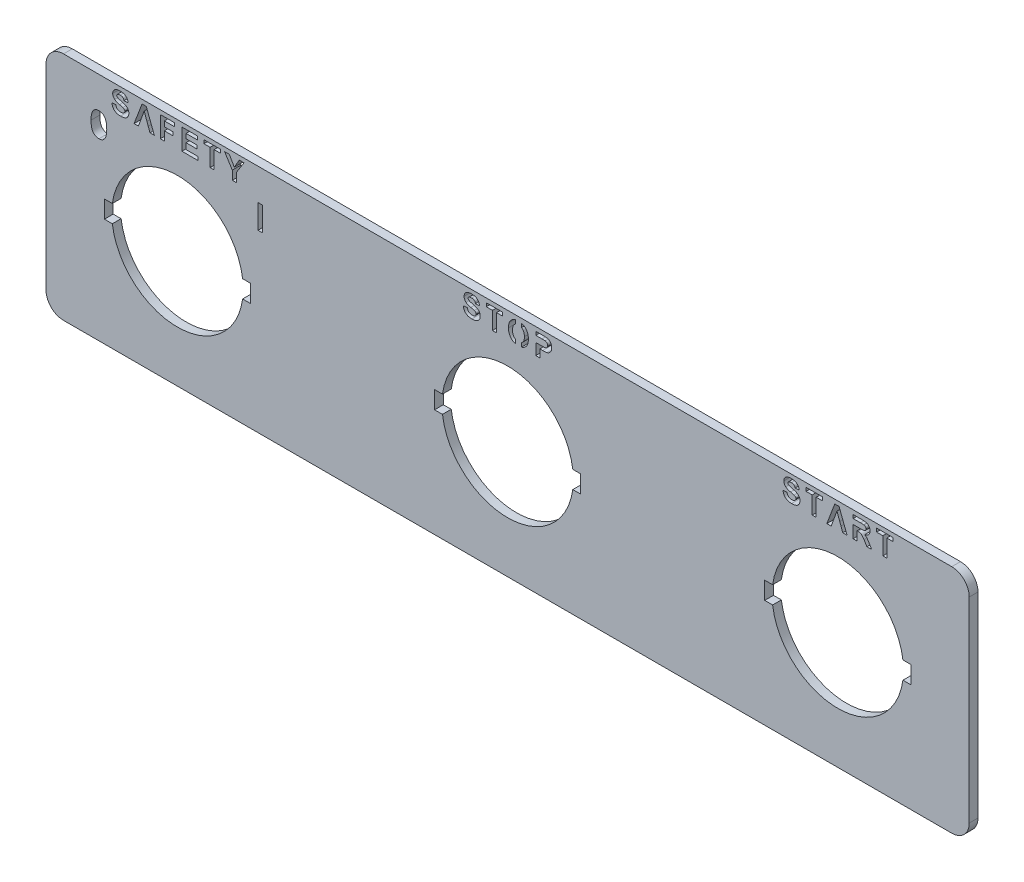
SolidWorks part; units mm, degrees
ref_plane "Ebene vorne" through (0, 0, 0) normal (0, 0, 1) x (1, 0, 0)
ref_plane "Ebene oben" through (0, 0, 0) normal (0, 1, 0) x (1, 0, 0)
ref_plane "Ebene rechts" through (0, 0, 0) normal (1, 0, 0) x (0, 0, -1)
sketch "Skizze3" plane through (0, 0, 0) normal (0, 0, 1) x (1, 0, 0)
  line L5 (11.1496, 1.5) -> (12.5, 1.5)
  line L6 (-12.5, -1.5) -> (-11.1496, -1.5)
  line L14 (-12.5, -1.5) -> (-12.5, 1.5)
  line L18 (-12.5, 1.5) -> (-11.1496, 1.5)
  line L19 (12.5, -1.5) -> (12.5, 1.5)
  line L21 (-12.5, -1.5) -> (12.5, 1.5) construction
  line L22 (-12.5, 1.5) -> (12.5, -1.5) construction
  line L23 (11.1496, -1.5) -> (12.5, -1.5)
  line L24 (67.6496, 1.5) -> (69, 1.5)
  line L25 (44, -1.5) -> (45.3504, -1.5)
  line L26 (44, -1.5) -> (44, 1.5)
  line L27 (44, 1.5) -> (45.3504, 1.5)
  line L28 (69, -1.5) -> (69, 1.5)
  line L29 (44, -1.5) -> (69, 1.5) construction
  line L30 (44, 1.5) -> (69, -1.5) construction
  line L31 (67.6496, -1.5) -> (69, -1.5)
  line L32 (124.1496, 1.5) -> (125.5, 1.5)
  line L33 (100.5, -1.5) -> (101.8504, -1.5)
  line L34 (100.5, -1.5) -> (100.5, 1.5)
  line L35 (100.5, 1.5) -> (101.8504, 1.5)
  line L36 (125.5, -1.5) -> (125.5, 1.5)
  line L37 (100.5, -1.5) -> (125.5, 1.5) construction
  line L38 (100.5, 1.5) -> (125.5, -1.5) construction
  line L39 (124.1496, -1.5) -> (125.5, -1.5)
  line L40 (44, 15.2) -> (69, 15.2) construction
  line L45 (-15, 10) -> (15, 10) construction
  line L46 (132.5, 19.5) -> (-19.5, 19.5)
  line L47 (100.5, 15.2) -> (125.5, 15.2) construction
  line L48 (135.5, 16.5) -> (135.5, -17)
  line L49 (-12.5, 15.2) -> (12.5, 15.2) construction
  line L50 (132.5, -20) -> (-19.5, -20)
  line L51 (-22.5, 16.5) -> (-22.5, -17)
  arc A9 (-11.1496, -1.5) -> (11.1496, -1.5) centre (0, 0) ccw
  arc A10 (11.1496, 1.5) -> (-11.1496, 1.5) centre (0, 0) ccw
  arc A11 (45.3504, -1.5) -> (67.6496, -1.5) centre (56.5, 0) ccw
  arc A12 (67.6496, 1.5) -> (45.3504, 1.5) centre (56.5, 0) ccw
  arc A13 (101.8504, -1.5) -> (124.1496, -1.5) centre (113, 0) ccw
  arc A14 (124.1496, 1.5) -> (101.8504, 1.5) centre (113, 0) ccw
  circle A15 centre (0, 0) radius 14.25 construction
  circle A16 centre (56.5, 0) radius 14.25 construction
  circle A17 centre (113, 0) radius 14.25 construction
  arc A18 (132.5, 19.5) -> (135.5, 16.5) centre (132.5, 16.5) cw
  arc A19 (135.5, -17) -> (132.5, -20) centre (132.5, -17) cw
  arc A20 (-19.5, -20) -> (-22.5, -17) centre (-19.5, -17) cw
  arc A21 (-19.5, 19.5) -> (-22.5, 16.5) centre (-19.5, 16.5) ccw
  point P38 (0, 10)
  dimension "D3" = 25
  dimension "D4" = 56.5
  dimension "D6" = 56.5
  dimension "D7" = 10
  dimension "D11" = 28.5
  dimension "D1" = 22.5
  dimension "D14" = 3
  dimension "D2" = 3
  dimension "D5" = 10
  dimension "D8" = 20
  dimension "D9" = 19.5
  dimension "D10" = 4.3
  dimension "D12" = 30
  dimension "D13" = 10
sketch "Skizze4" plane through (0, 0, 0) normal (0, 0, 1) x (1, 0, 0)
  text T0 "SAFETY" font "Arial" height in points 14
  text T1 "STOP" font "Arial" height in points 14
  text T2 "START" font "Arial" height in points 14
  text T3 "0" font "Arial" height in points 16
  text T4 "I" font "Arial" height in points 16
extrude "Aufsatz-Linear austragen1" add sketch "Skizze3" along normal blind 1.5
extrude "Schnitt-Linear austragen1" cut sketch "Skizze4" along normal through all
sketch "Skizze6" plane through (0, 0, 1.5) normal (0, 0, 1) x (1, 0, 0)
  spline S6 degree 3 poles (3873.6577, -933.3469) (-39.5137, 8.3469) (-13.7865, 6.7817) (-12.9406, 11.2113) (-12.9261, 11.3163) (-12.914, 11.4338) (-12.904, 11.5642) (-12.8979, 11.7072) (-12.609, 22.3337) (-34.1388, 33.2601) (3986.7867, -20.2946) knots -13.264132 -13.264132 -13.264132 -13.264132 0.082643 0.176812 0.282638 0.401264 0.531994 0.675701 0.831686 32.493345 32.493345 32.493345 32.493345 only from (-12.9807, 11.0356) to (-12.8927, 12.0267)
  spline S7 degree 3 poles (3986.6819, 50.9542) (-37.5673, -6.4828) (-12.6072, 3.116) (-12.8974, 12.3442) (-12.9022, 12.4848) (-12.9119, 12.6115) (-12.9216, 12.7248) (-12.9361, 12.824) (-12.9506, 12.9104) (-12.9756, 13.0036) (-13.0095, 13.1016) (-13.0557, 13.2013) (-13.1081, 13.2798) (-13.1675, 13.3374) (-13.232, 13.3763) (-13.2994, 13.4043) (-16.3228, 14.1045) (-23.0838, -19.3787) (415.0507, 3990.1408) knots -16.330429 -16.330429 -16.330429 -16.330429 0.100697 0.193034 0.277511 0.35372 0.421648 0.48196 0.534145 0.579041 0.655378 0.720508 0.776233 0.824061 0.868169 0.910885 0.954949 6.415181 6.415181 6.415181 6.415181 only from (-12.8927, 12.0267) to (-13.4458, 13.4244)
  spline S8 degree 3 poles (-457.9549, 3988.5028) (-3.6833, -19.5071) (-10.5836, 14.1072) (-13.5925, 13.4042) (-13.6605, 13.3764) (-13.7249, 13.3376) (-13.7842, 13.2837) (-13.8344, 13.2113) (-15.7306, 9.3294) (16.2937, -7.5721) (-3751.4808, 1437.4768) knots -13.457133 -13.457133 -13.457133 -13.457133 0.112424 0.222385 0.330122 0.441243 0.558075 0.686949 0.834033 19.885814 19.885814 19.885814 19.885814 only from (-13.4458, 13.4244) to (-13.9109, 13.0211)
  spline S9 degree 3 poles (-3901.6055, 952.9122) (12.8697, 15.5823) (-13.1246, 17.2303) (-13.9511, 12.8445) (-13.9655, 12.7389) (-13.9777, 12.6209) (-13.9877, 12.4902) (-13.9938, 12.3469) (-14.2827, 1.6908) (7.2925, -9.2596) (-4013.6656, 43.0855) knots -13.079113 -13.079113 -13.079113 -13.079113 0.082373 0.177042 0.283337 0.401576 0.532699 0.675937 0.831413 32.478628 32.478628 32.478628 32.478628 only from (-13.9109, 13.0211) to (-13.999, 12.0267)
  spline S10 degree 3 poles (-4012.9474, 89.5388) (1.4049, 40.4513) (-14.2348, 26.1724) (-13.9951, 11.7094) (-13.9878, 11.5692) (-13.9806, 11.4423) (-13.9685, 11.329) (-13.9564, 11.2291) (-13.9396, 11.1432) (-13.9168, 11.0498) (-13.8822, 10.952) (-13.8348, 10.8534) (-13.784, 10.7742) (-13.7241, 10.7175) (-13.6593, 10.6794) (-13.5921, 10.6515) (-10.4784, 9.973) (-4.0347, 42.5474) (-405.5827, -3969.4199) knots -25.774494 -25.774494 -25.774494 -25.774494 0.100835 0.193283 0.277401 0.353678 0.422236 0.482563 0.534908 0.579742 0.655714 0.721145 0.776666 0.824218 0.868127 0.911357 0.954889 6.572718 6.572718 6.572718 6.572718 only from (-13.999, 12.0267) to (-13.4458, 10.6322)
  spline S11 degree 3 poles (464.8514, -3960.4286) (-23.5123, 44.3755) (-16.2613, 9.9385) (-13.2988, 10.6528) (-13.2306, 10.6798) (-13.1667, 10.7193) (-13.1075, 10.7729) (-13.0573, 10.8453) (-11.1616, 14.7243) (-43.188, 31.6756) (3722.6956, -1418.4246) knots -13.272477 -13.272477 -13.272477 -13.272477 0.113638 0.222386 0.331252 0.44131 0.558128 0.686986 0.834053 19.873398 19.873398 19.873398 19.873398 only from (-13.4458, 10.6322) to (-12.9807, 11.0356)
  spline S12 degree 3 poles (-12.9807, 11.0356) (-12.9736, 11.0621) (-12.9582, 11.1189) (-12.9406, 11.2113) (-12.9261, 11.3163) (-12.914, 11.4338) (-12.904, 11.5642) (-12.8979, 11.7072) (-12.8937, 11.8628) (-12.893, 11.9707) (-12.8927, 12.0267) knots 0 0 0 0 0.082643 0.176812 0.282638 0.401264 0.531994 0.675701 0.831686 1 1 1 1
  spline S13 degree 3 poles (-12.8927, 12.0267) (-12.8926, 12.0826) (-12.8926, 12.19) (-12.8974, 12.3442) (-12.9022, 12.4848) (-12.9119, 12.6115) (-12.9216, 12.7248) (-12.9361, 12.824) (-12.9506, 12.9104) (-12.9756, 13.0036) (-13.0095, 13.1016) (-13.0557, 13.2013) (-13.1081, 13.2798) (-13.1675, 13.3374) (-13.232, 13.3763) (-13.2994, 13.4043) (-13.3712, 13.421) (-13.4208, 13.4233) (-13.4458, 13.4244) knots 0 0 0 0 0.100697 0.193034 0.277511 0.35372 0.421648 0.48196 0.534145 0.579041 0.655378 0.720508 0.776233 0.824061 0.868169 0.910885 0.954949 1 1 1 1
  spline S14 degree 3 poles (-13.4458, 13.4244) (-13.4709, 13.4233) (-13.5205, 13.421) (-13.5925, 13.4042) (-13.6605, 13.3764) (-13.7249, 13.3376) (-13.7842, 13.2837) (-13.8344, 13.2113) (-13.8777, 13.1226) (-13.8994, 13.0562) (-13.9109, 13.0211) knots 0 0 0 0 0.112424 0.222385 0.330122 0.441243 0.558075 0.686949 0.834033 1 1 1 1
  spline S15 degree 3 poles (-13.9109, 13.0211) (-13.9181, 12.9945) (-13.9336, 12.9375) (-13.9511, 12.8445) (-13.9655, 12.7389) (-13.9777, 12.6209) (-13.9877, 12.4902) (-13.9938, 12.3469) (-13.998, 12.1911) (-13.9987, 12.0829) (-13.999, 12.0267) knots 0 0 0 0 0.082373 0.177042 0.283337 0.401576 0.532699 0.675937 0.831413 1 1 1 1
  spline S16 degree 3 poles (-13.999, 12.0267) (-13.9985, 11.9707) (-13.9976, 11.8634) (-13.9951, 11.7094) (-13.9878, 11.5692) (-13.9806, 11.4423) (-13.9685, 11.329) (-13.9564, 11.2291) (-13.9396, 11.1432) (-13.9168, 11.0498) (-13.8822, 10.952) (-13.8348, 10.8534) (-13.784, 10.7742) (-13.7241, 10.7175) (-13.6593, 10.6794) (-13.5921, 10.6515) (-13.5201, 10.6358) (-13.4709, 10.6334) (-13.4458, 10.6322) knots 0 0 0 0 0.100835 0.193283 0.277401 0.353678 0.422236 0.482563 0.534908 0.579742 0.655714 0.721145 0.776666 0.824218 0.868127 0.911357 0.954889 1 1 1 1
  spline S17 degree 3 poles (-13.4458, 10.6322) (-13.4205, 10.6333) (-13.3709, 10.6354) (-13.2988, 10.6528) (-13.2306, 10.6798) (-13.1667, 10.7193) (-13.1075, 10.7729) (-13.0573, 10.8453) (-13.0139, 10.934) (-12.9922, 11.0004) (-12.9807, 11.0356) knots 0 0 0 0 0.113638 0.222386 0.331252 0.44131 0.558128 0.686986 0.834053 1 1 1 1
  dimension "D1" = 0
extrude "Schnitt-Linear austragen2" cut sketch "Skizze6" against normal blind 10
sketch "Skizze5" plane through (0, 0, 1.5) normal (0, 0, 1) x (1, 0, 0)
  line L0 (-6.1688, 16.629) -> (-5.2252, 16.629)
  line L1 (-5.2252, 16.629) -> (-5.0055, 16.0298)
  line L2 (-5.0055, 16.0298) -> (-6.3856, 16.0298)
  line L3 (-6.3856, 16.0298) -> (-6.1688, 16.629)
  line L4 (57.8754, 18.792) -> (57.8754, 18.1331)
  line L5 (58.8754, 18.7767) -> (58.8754, 18.113)
  line L6 (57.8754, 15.87) -> (57.8754, 15.2068)
  line L7 (58.8754, 15.8919) -> (58.8754, 15.2168)
  line L8 (62.0133, 18.1964) -> (61.3219, 18.1964)
  line L9 (61.3219, 15.2) -> (61.3219, 18.7956) construction
  line L10 (62.0133, 17.1361) -> (61.3219, 17.1361)
  line L11 (61.3219, 17.1361) -> (61.3219, 18.1964)
  line L12 (62.0133, 18.1964) -> (62.0133, 17.1361)
  line L13 (116.3144, 18.1964) -> (115.623, 18.1964)
  line L14 (115.623, 15.2) -> (115.623, 18.7956) construction
  line L15 (116.3144, 17.3205) -> (115.623, 17.3205)
  line L16 (115.623, 17.3205) -> (115.623, 18.1964)
  line L18 (112.3906, 16.629) -> (112.1738, 16.0298)
  line L19 (112.1738, 16.0298) -> (113.5539, 16.0298)
  line L20 (113.5539, 16.0298) -> (113.3342, 16.629)
  line L21 (113.3342, 16.629) -> (112.3906, 16.629)
  line L30 (116.3144, 18.1964) -> (116.3144, 17.3205)
  line L31 (116.3144, 18.1964) -> (116.3144, 17.3205) construction
  line L32 (116.9022, 18.1964) -> (116.3144, 18.1964) construction
  line L33 (116.3144, 17.3205) -> (116.8712, 17.3205) construction
  spline S5 degree 3 poles (-668.1263, 1882.3584) (56.5299, 0.8104) (54.1468, 17.573) (57.7612, 18.7636) (57.8516, 18.7869) (57.9447, 18.8078) (58.0413, 18.8221) (58.1406, 18.8342) (62.8689, 19.1248) (67.9498, 3.712) (23.0984, 2018.4918) knots -14.341585 -14.341585 -14.341585 -14.341585 0.115824 0.23411 0.354106 0.476628 0.602521 0.731466 0.863531 18.90366 18.90366 18.90366 18.90366 only from (57.5904, 18.7006) to (58.3481, 18.8417) construction
  spline S6 degree 3 poles (-75.2272, 2013.7366) (67.0669, -2.0397) (61.8494, 18.7442) (58.14, 18.2247) (58.0389, 18.2016) (57.9434, 18.167) (57.8533, 18.1234) (57.7691, 18.0693) (57.69, 18.0064) (57.6173, 17.9334) (57.5511, 17.8511) (57.4943, 17.7582) (57.4459, 17.6558) (57.4062, 17.5436) (57.3767, 17.4213) (57.3541, 17.2898) (56.8835, 12.0482) (76.8913, 6.0633) (-1941.6548, 78.5367) knots -5.982542 -5.982542 -5.982542 -5.982542 0.061375 0.120058 0.176955 0.232008 0.287027 0.341454 0.39662 0.453121 0.51082 0.570319 0.63207 0.697128 0.766012 0.839041 0.916898 9.42551 9.42551 9.42551 9.42551 only from (58.3567, 18.2425) to (57.339, 17) construction
  spline S7 degree 3 poles (164.1406, 2015.9831) (46.1506, -4.181) (53.149, 19.5046) (58.7157, 18.8147) (58.8867, 18.7768) (59.0474, 18.7222) (59.1992, 18.6539) (59.341, 18.5691) (59.4728, 18.4688) (59.5946, 18.3544) (59.7042, 18.2261) (59.7997, 18.085) (59.8798, 17.9319) (59.9458, 17.7671) (59.9965, 17.5901) (60.0331, 17.4015) (60.7044, 11.2163) (36.8067, 3.8461) (2058.2627, 100.5207) knots -5.704027 -5.704027 -5.704027 -5.704027 0.06654 0.13022 0.191362 0.250596 0.30863 0.366331 0.424068 0.482723 0.541892 0.601416 0.661683 0.723504 0.787984 0.855208 0.925639 7.328452 7.328452 7.328452 7.328452 only from (58.3481, 18.8417) to (60.0588, 16.9928) construction
  spline S8 degree 3 poles (2058.0137, 89.3945) (39.5403, 6.1427) (59.8294, 12.1528) (59.352, 17.2983) (59.3306, 17.4293) (59.3008, 17.5505) (59.2615, 17.6618) (59.2145, 17.7637) (59.1578, 17.8554) (59.0926, 17.9371) (59.0206, 18.009) (58.9428, 18.0719) (58.8589, 18.1243) (58.7696, 18.1684) (58.6741, 18.2011) (58.5733, 18.2249) (54.8359, 18.7406) (49.7101, -1.896) (181.6324, 2014.4014) knots -8.32832 -8.32832 -8.32832 -8.32832 0.083271 0.161262 0.234331 0.303298 0.367916 0.429919 0.488937 0.54647 0.602793 0.657465 0.71205 0.766554 0.822225 0.879123 0.938206 7.066667 7.066667 7.066667 7.066667 only from (59.3673, 17.0101) to (58.3567, 18.2425) construction
  spline S9 degree 3 poles (-1940.7517, -69.5108) (77.9912, 27.5614) (56.8559, 21.6138) (57.3553, 16.7141) (57.3769, 16.5834) (57.4087, 16.462) (57.4489, 16.3497) (57.4981, 16.2465) (57.5561, 16.1523) (57.6245, 16.0689) (57.6986, 15.9945) (57.7784, 15.9301) (57.8627, 15.8746) (57.9528, 15.8309) (58.0469, 15.7961) (58.1457, 15.7704) (61.8591, 15.2655) (66.8083, 35.3586) (-53.8063, -1981.023) knots -7.891569 -7.891569 -7.891569 -7.891569 0.082097 0.158979 0.231779 0.300627 0.365962 0.428378 0.4891 0.54829 0.606037 0.662131 0.717441 0.772225 0.827163 0.882835 0.94047 6.998867 6.998867 6.998867 6.998867 only from (57.339, 17) to (58.3567, 15.7532) construction
  spline S10 degree 3 poles (-43.0885, -1982.1705) (70.6176, 38.1053) (63.6147, 14.4929) (57.9879, 15.1809) (57.8161, 15.219) (57.6546, 15.2727) (57.5022, 15.3402) (57.3604, 15.4242) (57.2291, 15.5239) (57.1084, 15.6376) (56.999, 15.7642) (56.9056, 15.9044) (56.8247, 16.0548) (56.7603, 16.2175) (56.7087, 16.3909) (56.6735, 16.576) (55.9951, 22.5719) (80.1405, 29.9075) (-1940.9736, -78.3811) knots -5.80872 -5.80872 -5.80872 -5.80872 0.067555 0.132224 0.19408 0.253925 0.312527 0.370537 0.428356 0.487097 0.546163 0.605433 0.665483 0.72697 0.790718 0.857154 0.926601 7.183404 7.183404 7.183404 7.183404 only from (58.3582, 15.1539) to (56.6475, 16.9762) construction
  spline S11 degree 3 poles (181.2146, -1980.4403) (49.8619, 35.5709) (54.895, 15.2604) (58.5676, 15.7706) (58.6666, 15.7952) (58.7603, 15.8298) (58.8492, 15.8743) (58.9332, 15.9284) (59.0117, 15.9931) (59.0857, 16.0665) (59.1522, 16.1504) (59.2098, 16.2447) (59.259, 16.3485) (59.2992, 16.4619) (59.3302, 16.5852) (59.3509, 16.7183) (59.8529, 21.7022) (38.6694, 27.7466) (2057.3822, -70.2364) knots -5.914694 -5.914694 -5.914694 -5.914694 0.059322 0.116755 0.172136 0.226881 0.280766 0.335336 0.390928 0.447913 0.506402 0.566704 0.629258 0.695109 0.764382 0.838031 0.916611 8.998372 8.998372 8.998372 8.998372 only from (58.3567, 15.7532) to (59.3673, 17.0101) construction
  spline S12 degree 3 poles (2057.7911, -76.877) (36.5843, 30.0787) (60.7108, 22.6715) (60.0328, 16.5871) (59.9977, 16.3998) (59.9458, 16.2246) (59.8818, 16.06) (59.8008, 15.9082) (59.7073, 15.767) (59.5979, 15.6401) (59.4782, 15.525) (59.3464, 15.426) (59.2057, 15.3411) (59.0548, 15.2726) (58.8945, 15.219) (58.7244, 15.1809) (53.1682, 14.4923) (46.215, 38.1327) (161.5472, -1982.0822) knots -6.262516 -6.262516 -6.262516 -6.262516 0.074278 0.144606 0.211667 0.275783 0.337863 0.39825 0.45762 0.516768 0.57539 0.6331 0.690914 0.749047 0.808298 0.869542 0.933334 6.725565 6.725565 6.725565 6.725565 only from (60.0588, 16.9928) to (58.3582, 15.1539) construction
  spline S14 degree 3 poles (57.8754, 18.792) (57.8982, 18.7973) (57.9529, 18.809) (58.0413, 18.8221) (58.1406, 18.8342) (58.2433, 18.8405) (58.3128, 18.8413) (58.3481, 18.8417) knots 0.386229 0.386229 0.386229 0.386229 0.476628 0.602521 0.731466 0.863531 1 1 1 1
  spline S16 degree 3 poles (58.3481, 18.8417) (58.4113, 18.8402) (58.535, 18.8371) (58.7115, 18.8152) (58.8234, 18.7908) (58.8754, 18.7767) knots 0 0 0 0 0.06654 0.13022 0.186915 0.186915 0.186915 0.186915
  spline S17 degree 3 poles (58.8754, 18.113) (58.8696, 18.1164) (58.8353, 18.136) (58.7696, 18.1684) (58.6741, 18.2011) (58.5733, 18.2249) (58.4669, 18.2396) (58.394, 18.2415) (58.3567, 18.2425) knots 0.701038 0.701038 0.701038 0.701038 0.71205 0.766554 0.822225 0.879123 0.938206 1 1 1 1
  spline S18 degree 3 poles (58.3567, 18.2425) (58.3195, 18.2415) (58.2466, 18.2396) (58.14, 18.2247) (58.0389, 18.2016) (57.951, 18.1698) (57.8978, 18.1448) (57.8754, 18.1331) knots 0 0 0 0 0.061375 0.120058 0.176955 0.232008 0.273668 0.273668 0.273668 0.273668
  spline S19 degree 3 poles (58.3567, 15.7532) (58.3928, 15.7542) (58.4638, 15.7562) (58.5676, 15.7706) (58.6666, 15.7952) (58.7603, 15.8298) (58.829, 15.8642) (58.8663, 15.8863) (58.8754, 15.8919) knots 0 0 0 0 0.059322 0.116755 0.172136 0.226881 0.280766 0.298233 0.298233 0.298233 0.298233
  spline S20 degree 3 poles (57.8754, 15.87) (57.9007, 15.8562) (57.9569, 15.8294) (58.0469, 15.7961) (58.1457, 15.7704) (58.2497, 15.7562) (58.3207, 15.7542) (58.3567, 15.7532) knots 0.72456 0.72456 0.72456 0.72456 0.772225 0.827163 0.882835 0.94047 1 1 1 1
  spline S21 degree 3 poles (58.3582, 15.1539) (58.2945, 15.1555) (58.1698, 15.1586) (58.0085, 15.1783) (57.9119, 15.1981) (57.8754, 15.2068) knots 0 0 0 0 0.067555 0.132224 0.172073 0.172073 0.172073 0.172073
  spline S22 degree 3 poles (58.8754, 15.2168) (58.8262, 15.2038) (58.7175, 15.1801) (58.5444, 15.1586) (58.4212, 15.1555) (58.3582, 15.1539) knots 0.815663 0.815663 0.815663 0.815663 0.869542 0.933334 1 1 1 1
  point P12 (58.8754, 18.4449)
  dimension "D1" = 1
extrude "Aufsatz-Linear austragen3" add sketch "Skizze5" against normal up to surface (1.5 mm away)
